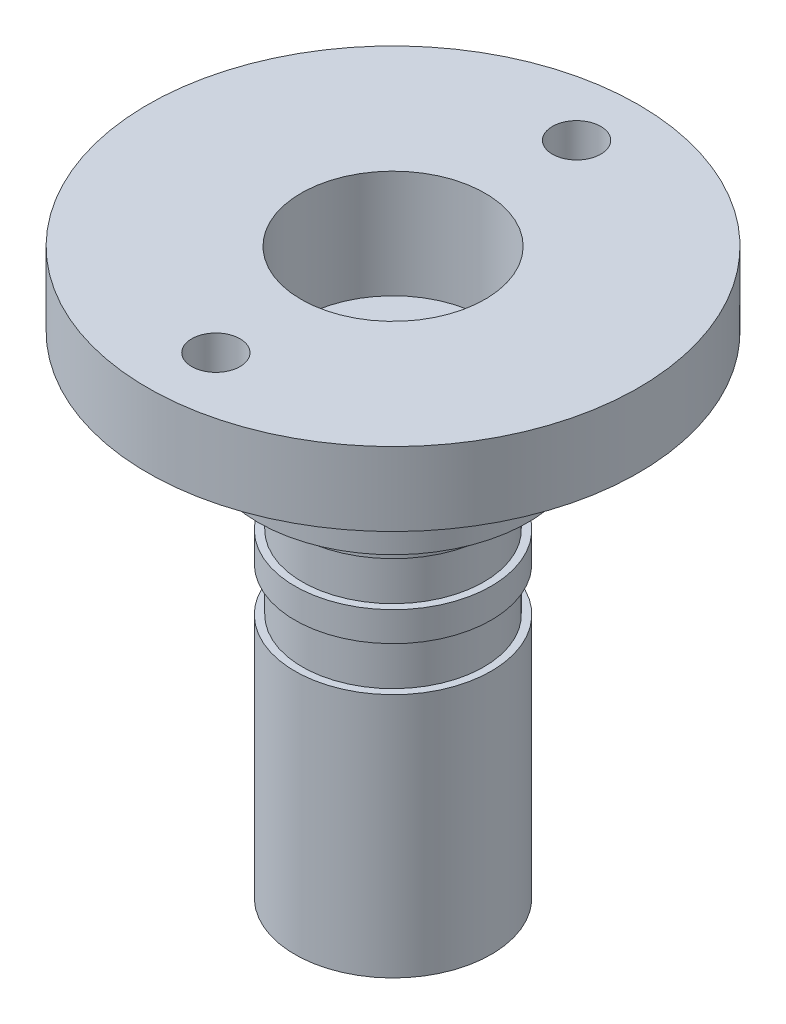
SolidWorks part; units mm, degrees
ref_plane "Front Plane" through (0, 0, 0) normal (0, 0, 1) x (1, 0, 0)
ref_plane "Top Plane" through (0, 0, 0) normal (0, 1, 0) x (1, 0, 0)
ref_plane "Right Plane" through (0, 0, 0) normal (1, 0, 0) x (0, 0, -1)
sketch "Sketch1" plane through (0, 0, 0) normal (0, 0, 1) x (1, 0, 0)
  line L0 (12.7, 16.51) -> (0, 16.51)
  line L1 (0, 16.51) -> (0, -12.7)
  line L2 (0, -12.7) -> (5.08, -12.7)
  line L3 (5.08, -12.7) -> (5.08, 0)
  line L4 (5.08, 0) -> (4.699, 0)
  line L5 (4.699, 0) -> (4.699, 2.286)
  line L6 (4.699, 2.286) -> (5.08, 2.286)
  line L7 (5.08, 2.286) -> (5.08, 3.81)
  line L8 (5.08, 3.81) -> (4.699, 3.81)
  line L9 (4.699, 3.81) -> (4.699, 6.096)
  line L10 (4.699, 6.096) -> (5.08, 6.096)
  line L11 (5.08, 6.096) -> (5.08, 7.62)
  line L12 (5.08, 7.62) -> (6.985, 7.62)
  line L13 (6.985, 7.62) -> (6.985, 12.7)
  line L14 (6.985, 12.7) -> (12.7, 12.7)
  line L15 (12.7, 12.7) -> (12.7, 16.51)
  line L16 (0, 16.51) -> (0, -12.7) construction
revolve "Revolve1" add sketch "Sketch1" angle 360 about L16
hole_wizard "M2 Clearance Hole1" positions "Sketch3" profile "Sketch2" hole size "M2" standard "ANSI Metric"
sketch "Sketch3" plane through (0, 12.7, 0) normal (0, -1, 0) x (-1, 0, 0)
  point P0 (-0.1851, -9.3562)
  point P1 (0, 9.4996)
sketch "Sketch2" plane through (0.1851, 12.7, 9.3562) normal (1, 0, 0) x (0, 0, -1)
  line L0 (0, 0) -> (0, 3.81)
  line L1 (0, 3.81) -> (1.2499, 3.81)
  line L2 (1.2499, 3.81) -> (1.2499, 0)
  line L5 (1.2499, 0) -> (0, 0)
  line L11 (0, -6.35) -> (0, 107.95) construction
  dimension "Thru Hole Dia." = 2.4999
  dimension "Thru Hole Depth" = 3.81
hole_wizard "Hole1" positions "Sketch5" profile "Sketch4" legacy
sketch "Sketch5" plane through (0, 16.51, 0) normal (0, 1, 0) x (1, 0, 0)
  point P0 (0, 0)
sketch "Sketch4" plane through (0, 16.51, 0) normal (1, 0, 0) x (0, 0, 1)
  line L0 (0, 0) -> (0, 29.21)
  line L1 (0, 29.21) -> (2.54, 29.21)
  line L2 (2.54, 29.21) -> (2.54, 5.588)
  line L3 (2.54, 5.588) -> (4.7625, 5.588)
  line L4 (4.7625, 5.588) -> (4.7625, 0)
  line L5 (4.7625, 0) -> (0, 0)
  line L6 (0, 110) -> (0, -10) construction
  dimension "Diameter" = 5.08
  dimension "Depth" = 29.21
  dimension "C-Bore Diameter" = 9.525
  dimension "C-Bore Depth" = 5.588
